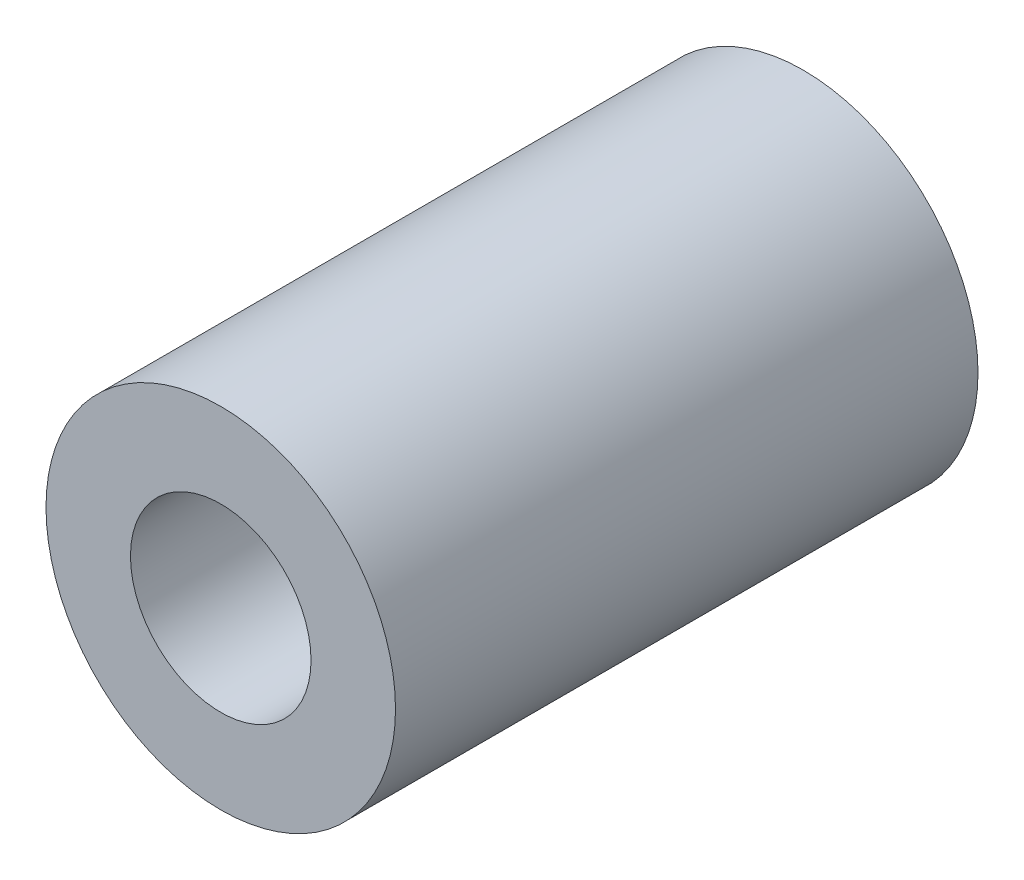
SolidWorks part; units mm, degrees
ref_plane "Plan de face" through (0, 0, 0) normal (0, 0, 1) x (1, 0, 0)
ref_plane "Plan de dessus" through (0, 0, 0) normal (0, 1, 0) x (1, 0, 0)
ref_plane "Plan de droite" through (0, 0, 0) normal (1, 0, 0) x (0, 0, -1)
sketch "Esquisse1" plane through (0, 0, 0) normal (0, 0, 1) x (1, 0, 0)
  circle A0 centre (0, 0) radius 1.55
  circle A1 centre (0, 0) radius 3
  dimension "D1" = 6
  dimension "D2" = 3.1
extrude "Extrusion1" add sketch "Esquisse1" along normal blind 10
